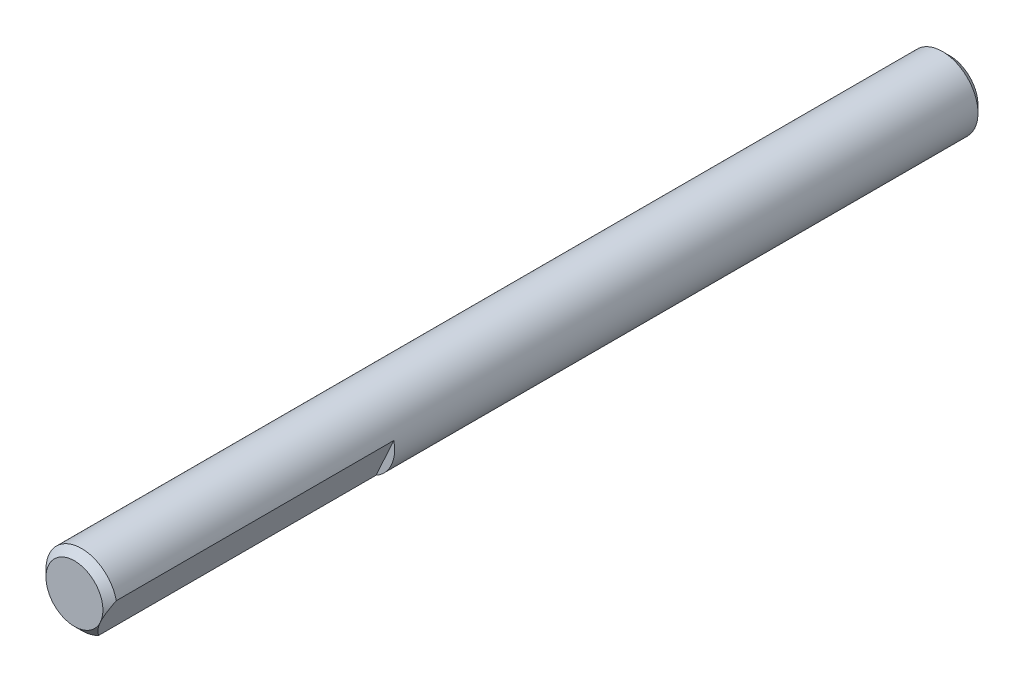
SolidWorks part; units mm, degrees
ref_plane "Front Plane" through (0, 0, 0) normal (0, 0, 1) x (1, 0, 0)
ref_plane "Top Plane" through (0, 0, 0) normal (0, 1, 0) x (1, 0, 0)
ref_plane "Right Plane" through (0, 0, 0) normal (1, 0, 0) x (0, 0, -1)
ref_plane "Plane1" through (0, 104.6172, 0) normal (0, -1, 0) x (1, 0, 0)
sketch "Sketch1" plane through (0, 104.6172, 0) normal (0, -1, 0) x (1, 0, 0)
  line L0 (-8.3955, 62.2) -> (-10.3955, 62.2)
  line L1 (-10.3955, 62.2) -> (-10.3955, 0.7)
  line L2 (-10.3955, 0.7) -> (-7.8955, 0.7)
  line L3 (-7.8955, 0.7) -> (-7.8955, 61.7)
  line L4 (-7.8955, 61.7) -> (-8.3955, 62.2)
  line L5 (-10.3955, 62.2) -> (-10.3955, 0.7) construction
revolve "Revolve1" add sketch "Sketch1" angle 360 about L5
ref_plane "Plane2" through (0, 0, 42.2) normal (0, 0, -1) x (-1, 0, 0)
sketch "Sketch2" plane through (0, 0, 42.2) normal (0, 0, -1) x (-1, 0, 0)
  line L0 (9.1929, 102.4254) -> (7.9547, 105.158)
  arc A0 (7.9547, 105.158) -> (9.1929, 102.4254) centre (10.3955, 104.6172) ccw
chamfer "Chamfer1" distance 0.5 angle 45 1 edges at (-12.8955, 104.6172, 0.7)
extrude "Cut-Extrude2" cut sketch "Sketch2" against normal blind 23
